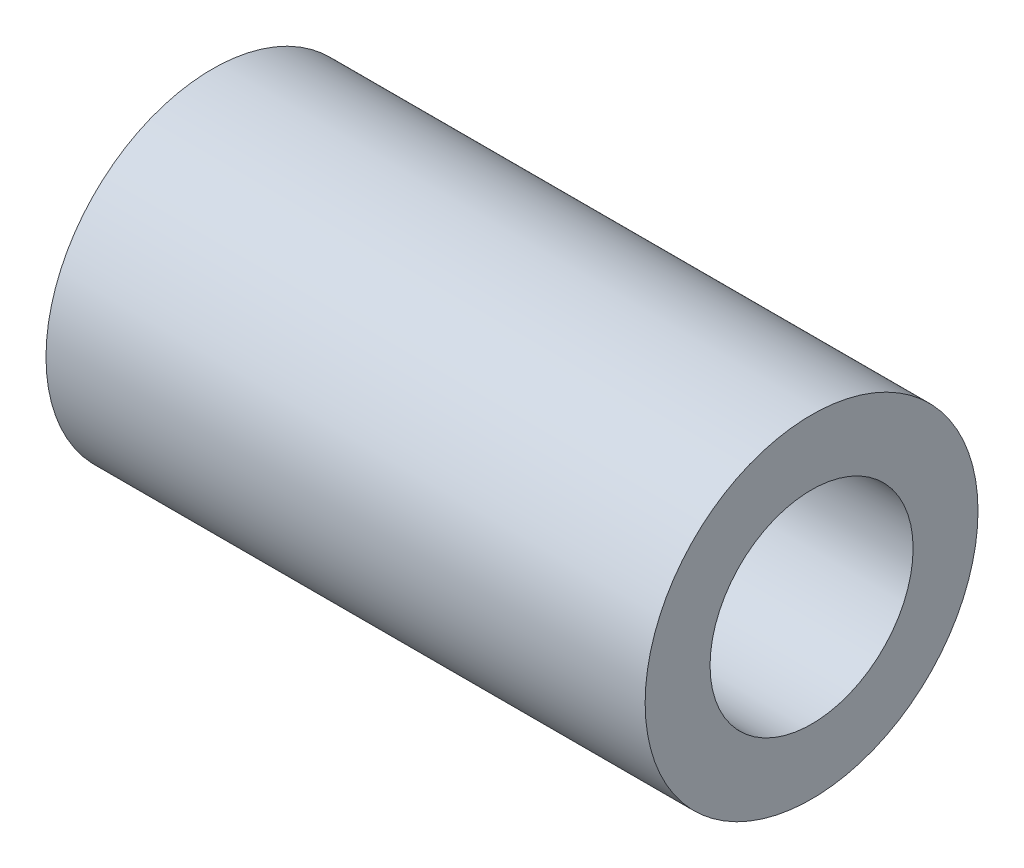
SolidWorks part; units mm, degrees
ref_plane "Front Plane" through (0, 0, 0) normal (0, 0, 1) x (1, 0, 0)
ref_plane "Top Plane" through (0, 0, 0) normal (0, 1, 0) x (1, 0, 0)
ref_plane "Right Plane" through (0, 0, 0) normal (1, 0, 0) x (0, 0, -1)
sketch "Sketch1" plane through (0, 0, 0) normal (1, 0, 0) x (0, 0, -1)
  circle A0 centre (0, 0) radius 3.05
  circle A1 centre (0, 0) radius 5
  dimension "D1" = 10
  dimension "D2" = 6.1
extrude "Boss-Extrude1" add sketch "Sketch1" along normal blind 18
